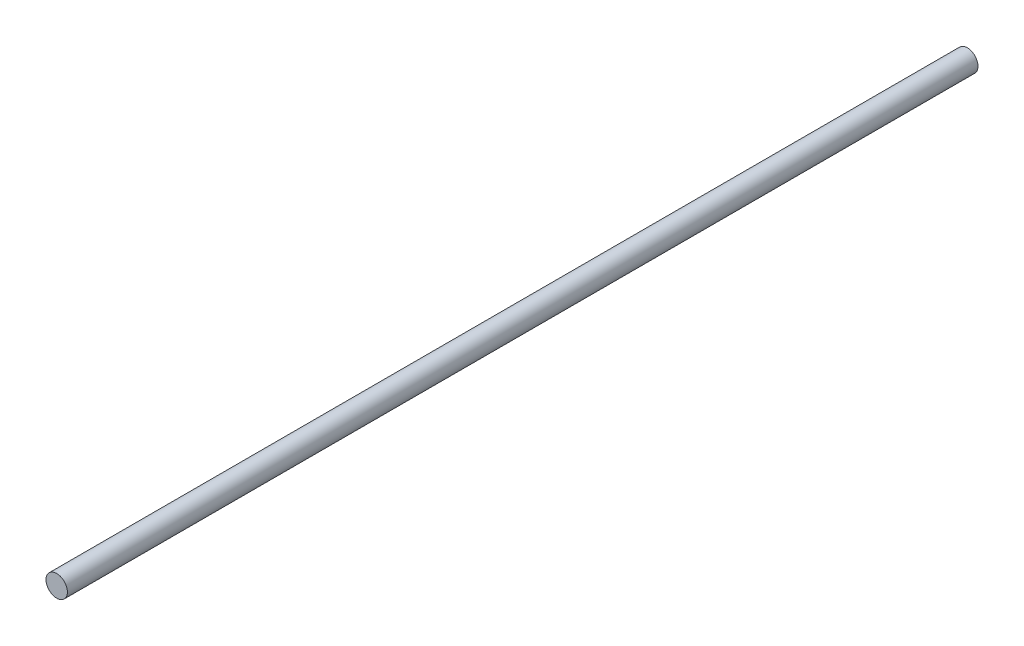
SolidWorks part; units mm, degrees
ref_plane "Front Plane" through (0, 0, 0) normal (0, 0, 1) x (1, 0, 0)
ref_plane "Top Plane" through (0, 0, 0) normal (0, 1, 0) x (1, 0, 0)
ref_plane "Right Plane" through (0, 0, 0) normal (1, 0, 0) x (0, 0, -1)
sketch "Sketch1" plane through (0, 0, 0) normal (0, 0, 1) x (1, 0, 0)
  circle A0 centre (0, 0) radius 30
  dimension "D1" = 60
extrude "Boss-Extrude1" add sketch "Sketch1" against normal blind 2550
